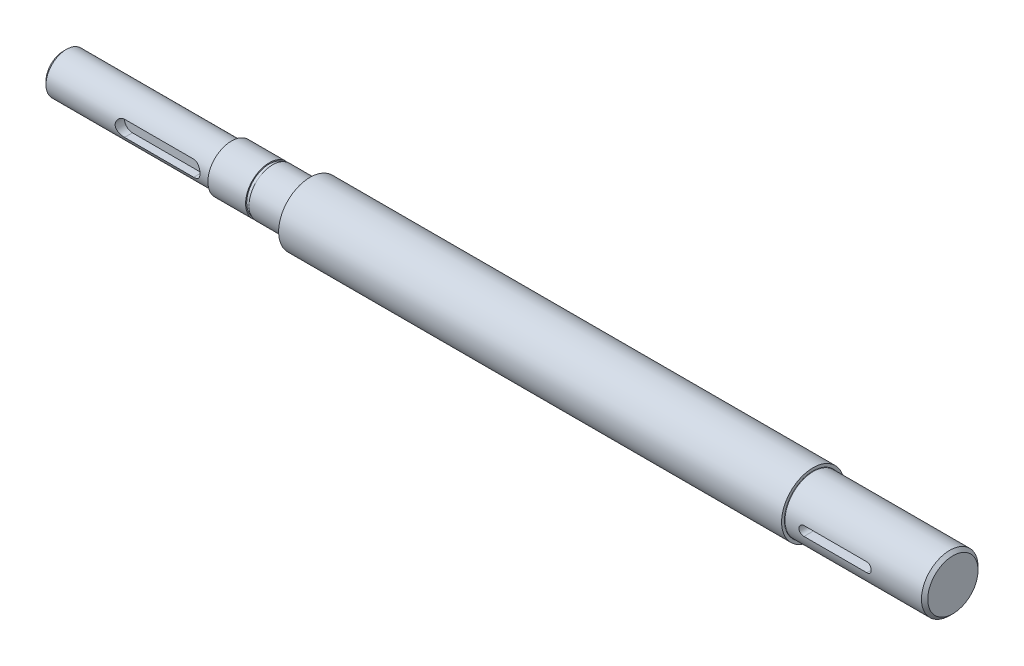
SolidWorks part; units mm, degrees
ref_plane "Front" through (0, 0, 0) normal (0, 0, 1) x (1, 0, 0)
ref_plane "Top" through (0, 0, 0) normal (0, 1, 0) x (1, 0, 0)
ref_plane "Right" through (0, 0, 0) normal (1, 0, 0) x (0, 0, -1)
sketch "Croquis1" plane through (0, 0, 0) normal (0, 0, 1) x (1, 0, 0)
  line L0 (0, 0) -> (0, 6.5)
  line L1 (0, 6.5) -> (53.5, 6.5)
  line L2 (53.5, 6.5) -> (53.5, 7.5)
  line L3 (53.5, 7.5) -> (65.5, 7.5)
  line L4 (65.5, 7.5) -> (65.5, 7.15)
  line L5 (65.5, 7.15) -> (66.6, 7.15)
  line L6 (66.6, 7.15) -> (66.6, 7.5)
  line L7 (66.6, 7.5) -> (78.1, 7.5)
  line L8 (78.5, 7.9) -> (78.5, 10)
  line L9 (78.5, 10) -> (238.5, 10)
  line L10 (238.5, 10) -> (238.5, 9)
  line L11 (238.5, 9) -> (283, 9)
  line L12 (0, 0) -> (835.678, 0) construction
  line L13 (283, 9) -> (283, 0)
  line L14 (0, 0) -> (283, 0)
  arc A0 (78.5, 7.9) -> (78.1, 7.5) centre (78.1, 7.9) cw
  point P17 (78.5, 7.5)
  dimension "D9" = 0.4
  dimension "D1" = 6.5
  dimension "D2" = 53.5
  dimension "D3" = 7.5
  dimension "D4" = 12
  dimension "D5" = 1.1
  dimension "D6" = 0.35
  dimension "D7" = 25
  dimension "D8" = 10
  dimension "D10" = 9
  dimension "D11" = 44.5
  dimension "D12" = 283
revolve "Revolución1" add sketch "Croquis1" angle 360 about L12
ref_plane "Plano1" through (0, 0, 7) normal (0, 0, 1) x (1, 0, 0)
sketch "Croquis3" plane through (0, 0, 7) normal (0, 0, 1) x (1, 0, 0)
  line L0 (53.5, 6.5) -> (53.5, -6.5) construction
  line L1 (25.5, 2.5) -> (47.5, 2.5)
  line L3 (25.5, -2.5) -> (47.5, -2.5)
  arc A0 (47.5, 2.5) -> (47.5, -2.5) centre (47.5, 0) cw
  arc A1 (25.5, 2.5) -> (25.5, -2.5) centre (25.5, 0) ccw
  dimension "D1" = 5
  dimension "D2" = 2.5
  dimension "D3" = 22
  dimension "D4" = 6
extrude "Cortar-Extruir1" cut sketch "Croquis3" against normal blind 3.5
ref_plane "Plano2" through (0, 0, 9) normal (0, 0, 1) x (1, 0, 0)
sketch "Croquis4" plane through (0, 0, 9) normal (0, 0, 1) x (1, 0, 0)
  line L1 (244.5, 1.5) -> (264.5, 1.5)
  line L3 (244.5, -1.5) -> (264.5, -1.5)
  arc A0 (264.5, 1.5) -> (264.5, -1.5) centre (264.5, 0) cw
  arc A1 (244.5, -1.5) -> (244.5, 1.5) centre (244.5, 0) cw
  dimension "D3" = 20
  dimension "D1" = 1.5
  dimension "D2" = 3
extrude "Cortar-Extruir2" cut sketch "Croquis4" against normal blind 3.5
chamfer "Chaflán1" distance 1 angle 45 2 edges at (0, 0, 6.5) (283, 0, 9)
fillet "Redondeo1" radius 0.1 2 edges at (53.5, 0, 6.5) (238.5, 0, 9)
